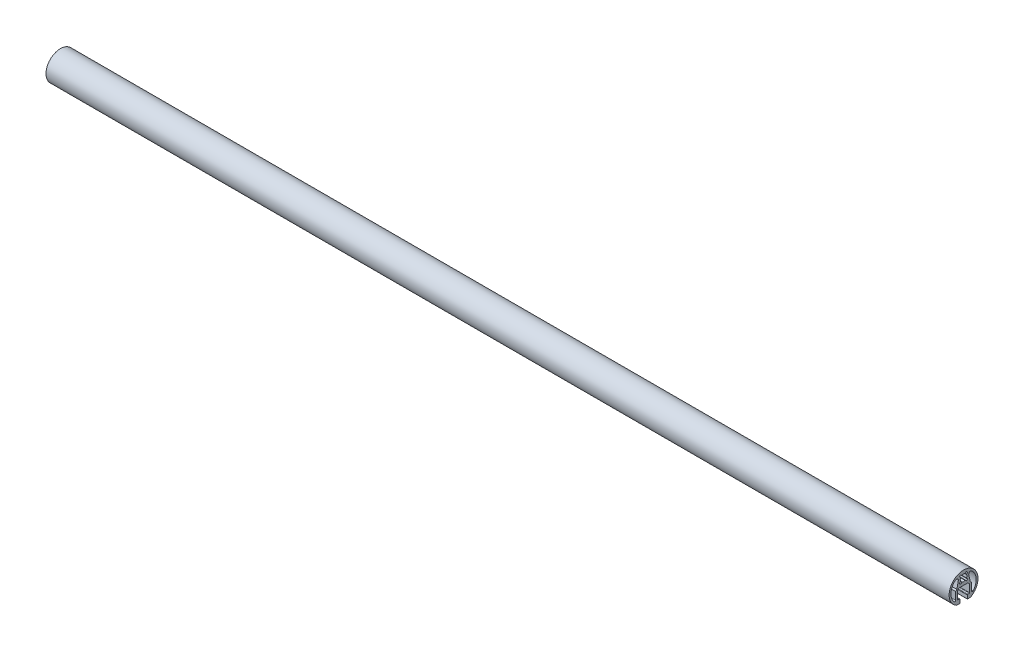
SolidWorks part; units mm, degrees
ref_plane "Front Plane" through (0, 0, 0) normal (0, 0, 1) x (1, 0, 0)
ref_plane "Top Plane" through (0, 0, 0) normal (0, 1, 0) x (1, 0, 0)
ref_plane "Right Plane" through (0, 0, 0) normal (1, 0, 0) x (0, 0, -1)
sketch "Sketch1" plane through (0, 0, 0) normal (0, 0, 1) x (1, 0, 0)
  line L0 (0, 0) -> (1000, 0)
  dimension "D1" = 1000
other "45-sarja 1.0016 KAHVAPROFIILI 32(1)"
ref_plane "Plane1" through (0, 0, 0) normal (1, 0, 0) x (0, -1, 0)
sketch "Model1" plane through (0, 0, 0) normal (1, 0, 0) x (0, -1, 0)
  line L0 (-3.3941, 4.3841) -> (-4.3841, 3.3941)
  line L1 (-4.3841, 2.9699) -> (-3.3633, 1.9491)
  line L2 (-3.3633, -1.9491) -> (-4.3841, -2.9698)
  line L3 (-4.3841, -3.3941) -> (-3.3941, -4.3841)
  line L4 (-2.9698, -4.3841) -> (-1.9491, -3.3633)
  line L5 (1.9491, -3.3633) -> (2.9698, -4.3841)
  line L6 (3.3941, -4.3841) -> (4.3841, -3.3941)
  line L7 (4.3841, -2.9698) -> (3.3633, -1.9491)
  line L8 (3.3633, 1.9491) -> (4.3841, 2.9698)
  line L9 (4.3841, 3.3941) -> (3.3941, 4.3841)
  line L10 (2.9698, 4.3841) -> (1.9491, 3.3633)
  line L11 (-1.9491, 3.3633) -> (-2.9698, 4.3841)
  line L12 (-0.2552, 5.7667) -> (7.3138, 7.4423)
  line L13 (7.3138, 7.4423) -> (8.6716, 8.8)
  line L14 (8.6716, 8.8) -> (17.0417, 8.8)
  line L15 (17.0417, -8.8) -> (8.6716, -8.8)
  line L16 (8.6716, -8.8) -> (7.3138, -7.4423)
  line L17 (7.3138, -7.4423) -> (-0.2552, -5.7667)
  line L18 (22.2, -4.1) -> (18.5, -4.1)
  line L19 (22.5, -7.746) -> (22.5, -4.4)
  line L20 (22.5, 4.4) -> (22.5, 7.746)
  line L21 (18.5, 4.1) -> (22.2, 4.1)
  line L22 (18, 6.5) -> (18, 4.6)
  line L23 (9.2, 6.8) -> (17.7, 6.8)
  line L24 (7.2, 4.8) -> (9.2, 6.8)
  line L25 (7.2, -4.8) -> (7.2, 4.8)
  line L26 (9.2, -6.8) -> (7.2, -4.8)
  line L27 (17.7, -6.8) -> (9.2, -6.8)
  line L28 (18, -4.6) -> (18, -6.5)
  line L29 (20.35, -4.1) -> (20.35, 4.1) construction
  arc A0 (-2.9698, 4.3841) -> (-3.3941, 4.3841) centre (-3.182, 4.1719) ccw
  arc A1 (-4.3841, 3.3941) -> (-4.3841, 2.9699) centre (-4.1719, 3.182) ccw
  arc A2 (-3.3056, 1.6059) -> (-3.3633, 1.9491) centre (-3.5754, 1.7369) ccw
  arc A3 (-3.3056, 1.6059) -> (-3.3056, -1.6059) centre (0, 0) ccw
  arc A4 (-3.3633, -1.9491) -> (-3.3056, -1.6059) centre (-3.5754, -1.7369) ccw
  arc A5 (-4.3841, -2.9698) -> (-4.3841, -3.3941) centre (-4.1719, -3.182) ccw
  arc A6 (-3.3941, -4.3841) -> (-2.9698, -4.3841) centre (-3.182, -4.1719) ccw
  arc A7 (-1.6059, -3.3056) -> (-1.9491, -3.3633) centre (-1.7369, -3.5754) ccw
  arc A8 (-1.6059, -3.3056) -> (1.6059, -3.3056) centre (0, 0) ccw
  arc A9 (1.9491, -3.3633) -> (1.6059, -3.3056) centre (1.7369, -3.5754) ccw
  arc A10 (2.9698, -4.3841) -> (3.3941, -4.3841) centre (3.182, -4.1719) ccw
  arc A11 (4.3841, -3.3941) -> (4.3841, -2.9698) centre (4.1719, -3.182) ccw
  arc A12 (3.3056, -1.6059) -> (3.3633, -1.9491) centre (3.5754, -1.7369) ccw
  arc A13 (3.3056, -1.6059) -> (3.3056, 1.6059) centre (0, 0) ccw
  arc A14 (3.3633, 1.9491) -> (3.3056, 1.6059) centre (3.5754, 1.7369) ccw
  arc A15 (4.3841, 2.9698) -> (4.3841, 3.3941) centre (4.1719, 3.182) ccw
  arc A16 (3.3941, 4.3841) -> (2.9698, 4.3841) centre (3.182, 4.1719) ccw
  arc A17 (1.6059, 3.3056) -> (1.9491, 3.3633) centre (1.7369, 3.5754) ccw
  arc A18 (1.6059, 3.3056) -> (-1.6059, 3.3056) centre (0, 0) ccw
  arc A19 (-1.9491, 3.3633) -> (-1.6059, 3.3056) centre (-1.7369, 3.5754) ccw
  arc A20 (17.0417, 8.8) -> (17.6987, 10.5538) centre (17.0417, 9.8) ccw
  arc A21 (17.6987, 10.5538) -> (-2.2187, 9.006) centre (8.5, 0) ccw
  arc A22 (-2.2187, 9.006) -> (-0.2552, 5.7667) centre (-0.6875, 7.7194) ccw
  arc A23 (-0.2552, -5.7667) -> (-2.2187, -9.006) centre (-0.6875, -7.7194) ccw
  arc A24 (-2.2187, -9.006) -> (17.6987, -10.5538) centre (8.5, 0) ccw
  arc A25 (17.6987, -10.5538) -> (17.0417, -8.8) centre (17.0417, -9.8) ccw
  arc A26 (22.5, -4.4) -> (22.2, -4.1) centre (22.2, -4.4) ccw
  arc A27 (22.5, 7.746) -> (22.5, -7.746) centre (8.5, 0) ccw
  arc A28 (22.2, 4.1) -> (22.5, 4.4) centre (22.2, 4.4) ccw
  arc A29 (18, 4.6) -> (18.5, 4.1) centre (18.5, 4.6) ccw
  arc A30 (18, 6.5) -> (17.7, 6.8) centre (17.7, 6.5) ccw
  arc A31 (17.7, -6.8) -> (18, -6.5) centre (17.7, -6.5) ccw
  arc A32 (18.5, -4.1) -> (18, -4.6) centre (18.5, -4.6) ccw
  point P92 (8.5, 16)
  point P93 (8.5, -16)
  point P94 (-7.5, 0)
  point P95 (0, 0)
  point P96 (22.5, 0)
  point P97 (0, 0)
